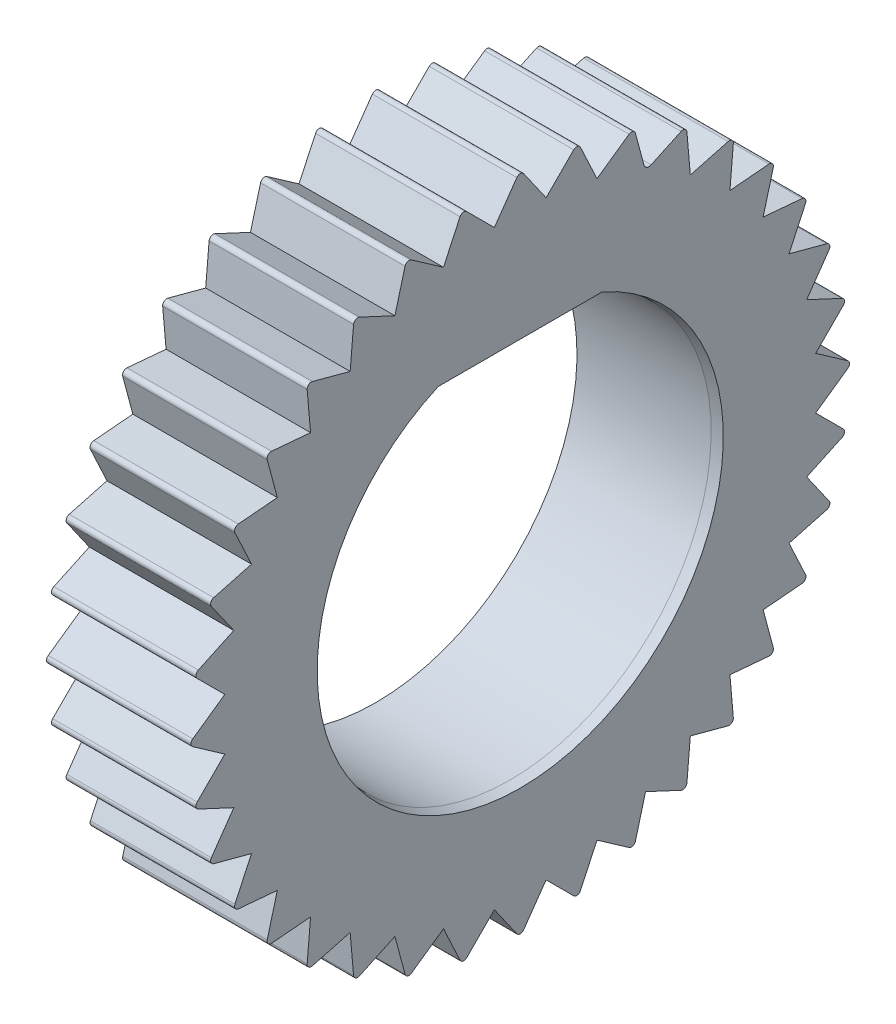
SolidWorks part; units mm, degrees
ref_plane "Plan1" through (0, 0, 0) normal (0, 0, 1) x (1, 0, 0)
ref_plane "Plan2" through (0, 0, 0) normal (0, 1, 0) x (1, 0, 0)
ref_plane "Plan3" through (0, 0, 0) normal (1, 0, 0) x (0, 0, -1)
sketch "Esquisse1" plane through (0, 0, 0) normal (0, 0, 1) x (1, 0, 0)
  line L0 (-60, 0) -> (70, 0) construction
  line L1 (-20, 28.25) -> (-6, 28.25)
  line L2 (-20, 19.5) -> (-6, 19.5)
  line L3 (-20, 28.25) -> (-20, 19.5)
  line L4 (-6, 28.25) -> (-6, 19.5)
  dimension "D1" = 28.25
  dimension "D2" = 19.5
  dimension "D3" = 14
revolve "Base-Révolution" add sketch "Esquisse1" angle 360 about L0
sketch "Esquisse2" plane through (-20, 0, 0) normal (-1, 0, 0) x (0, 0, 1)
  line L0 (0, 30) -> (0, -26.8) construction
  line L1 (-40, 0) -> (-24.8, 0) construction
  line L2 (-22.8, 0) -> (30, 0) construction
  circle A1 centre (0, 24.8) radius 2
  circle A2 centre (-24.8, 0) radius 2
  circle A3 centre (24.8, 0) radius 2
  circle A4 centre (0, -24.8) radius 2
  dimension "D2" = 4
  dimension "D3" = 4
  dimension "D4" = 4
  dimension "D5" = 4
extrude "Enlèv. mat.-Extru.1" [suppressed] cut sketch "Esquisse2" against normal blind 1
sketch "Esquisse4" plane through (-6, 0, 0) normal (1, 0, 0) x (0, 0, -1)
  line L0 (0, 0) -> (9.9382, 34.6588) construction
  line L1 (0, 0) -> (34.6588, -9.9382) construction
  line L2 (0, 30) -> (0, -26.8) construction
  line L3 (22.8, 0) -> (-30, 0) construction
  line L4 (0, 0) -> (30.3978, 8.7164) construction
  line L5 (0, 0) -> (-9.9382, 34.6588) construction
  line L6 (0, 0) -> (-27.1886, -7.7962) construction
  line L7 (0, 0) -> (7.7962, -27.1886) construction
  line L8 (0, 0) -> (-34.6588, 9.9382) construction
  line L9 (0, 0) -> (-8.7164, -30.3978) construction
  arc A0 (7.139, -24.8967) -> (24.8967, -7.139) centre (0, 0) ccw
  arc A1 (-6.0365, 21.0516) -> (-7.139, 24.8967) centre (-6.5877, 22.9742) ccw
  arc A2 (7.139, 24.8967) -> (6.0365, 21.0516) centre (6.5877, 22.9742) ccw
  arc A3 (-24.8967, 7.139) -> (-21.0516, 6.0365) centre (-22.9742, 6.5877) ccw
  arc A4 (-21.0516, -6.0365) -> (-24.8967, -7.139) centre (-22.9742, -6.5877) ccw
  arc A5 (-7.139, -24.8967) -> (-6.0365, -21.0516) centre (-6.5877, -22.9742) ccw
  arc A6 (6.0365, -21.0516) -> (7.139, -24.8967) centre (6.5877, -22.9742) ccw
  arc A7 (24.8967, -7.139) -> (21.0516, -6.0365) centre (22.9742, -6.5877) ccw
  arc A8 (21.0516, 6.0365) -> (24.8967, 7.139) centre (22.9742, 6.5877) ccw
  arc A9 (-6.0365, 21.0516) -> (-21.0516, 6.0365) centre (0, 0) ccw
  arc A10 (-7.139, 24.8967) -> (-24.8967, 7.139) centre (0, 0) ccw
  arc A11 (24.8967, 7.139) -> (7.139, 24.8967) centre (0, 0) ccw
  arc A12 (-24.8967, -7.139) -> (-7.139, -24.8967) centre (0, 0) ccw
  arc A13 (6.0365, -21.0516) -> (21.0516, -6.0365) centre (0, 0) ccw
  arc A15 (21.0516, 6.0365) -> (6.0365, 21.0516) centre (0, 0) ccw
  arc A16 (-21.0516, -6.0365) -> (-6.0365, -21.0516) centre (0, 0) ccw
  dimension "D8" = 2
  dimension "D1" = 16
  dimension "D2" = 16
  dimension "D3" = 16
  dimension "D4" = 16
  dimension "D5" = 16
  dimension "D6" = 16
  dimension "D7" = 16
extrude "Enlèv. mat.-Extru.3" [suppressed] cut sketch "Esquisse4" against normal blind 5.5
sketch "Esquisse5" [suppressed] plane through (-20, 0, 0) normal (-1, 0, 0) x (0, 0, 1)
  arc A0 (7.139, 24.8967) -> (6.0365, 21.0516) centre (6.5877, 22.9742) ccw
  arc A1 (-6.0365, 21.0516) -> (-7.139, 24.8967) centre (-6.5877, 22.9742) ccw
  arc A2 (-24.8967, 7.139) -> (-21.0516, 6.0365) centre (-22.9742, 6.5877) ccw
  arc A3 (-21.0516, -6.0365) -> (-24.8967, -7.139) centre (-22.9742, -6.5877) ccw
  arc A4 (-7.139, -24.8967) -> (-6.0365, -21.0516) centre (-6.5877, -22.9742) ccw
  arc A5 (21.0516, 6.0365) -> (24.8967, 7.139) centre (22.9742, 6.5877) ccw
  arc A6 (24.8967, -7.139) -> (21.0516, -6.0365) centre (22.9742, -6.5877) ccw
  arc A7 (6.0365, -21.0516) -> (7.139, -24.8967) centre (6.5877, -22.9742) ccw
  arc A8 (-24.8967, -7.139) -> (-7.139, -24.8967) centre (0, 0) ccw
  arc A9 (-21.0516, -6.0365) -> (-6.0365, -21.0516) centre (0, 0) ccw
  arc A10 (6.0365, -21.0516) -> (21.0516, -6.0365) centre (0, 0) ccw
  arc A11 (7.139, -24.8967) -> (24.8967, -7.139) centre (0, 0) ccw
  arc A12 (-6.0365, 21.0516) -> (-21.0516, 6.0365) centre (0, 0) ccw
  arc A13 (-7.139, 24.8967) -> (-24.8967, 7.139) centre (0, 0) ccw
  arc A14 (21.0516, 6.0365) -> (6.0365, 21.0516) centre (0, 0) ccw
  arc A15 (24.8967, 7.139) -> (7.139, 24.8967) centre (0, 0) ccw
  dimension "D1" = 4
  dimension "D2" = 4
  dimension "D3" = 4
  dimension "D4" = 4
  dimension "D5" = 4
  dimension "D6" = 4
  dimension "D7" = 4
  dimension "D8" = 4
extrude "Enlèv. mat.-Extru.4" [suppressed] cut sketch "Esquisse5" against normal blind 5.5
sketch "Esquisse6" plane through (-20, 0, 0) normal (-1, 0, 0) x (0, 0, 1)
  line L0 (0, 32.2) -> (0, -32) construction
  line L1 (-40, 0) -> (40, 0) construction
  line L2 (-0.3277, 31.7321) -> (-2.868, 28.104)
  line L3 (0.3277, 31.7321) -> (2.868, 28.104)
  arc A0 (0.3277, 31.7321) -> (-0.3277, 31.7321) centre (0, 31.5026) ccw
  arc A1 (2.868, 28.104) -> (-2.868, 28.104) centre (0, 0) ccw
  circle A2 centre (0, 0) radius 28.25 construction
  dimension "D1" = 0.4
  dimension "D2" = 35
  dimension "D3" = 35
extrude "Boss.-Extru.1" add sketch "Esquisse6" against normal blind 14
pattern_circular "Répétition circulaire1" count 36 every 10 about axis through (0, 0, 0) along (1, 0, 0) of "Boss.-Extru.1"
chamfer "Chanfrein2" distance 1 angle 10 1 edges at (-6, 0, 19.5)
fillet "Congé1" radius 0.5 1 edges at (-13, 26.0409, -12.1431)
pattern_circular "Répétition circulaire2" count 36 every 10 about axis through (-60, 0, 0) along (1, 0, 0) of "Répétition circulaire1"
sketch "Esquisse7" plane through (-20, 0, 0) normal (-1, 0, 0) x (0, 0, 1)
  line L0 (-8.9023, 18) -> (8.9023, 18)
  arc A0 (8.9023, 18) -> (-8.9023, 18) centre (0, 0) ccw
  dimension "D1" = 18
extrude "Extrusion1" add sketch "Esquisse7" against normal through all
